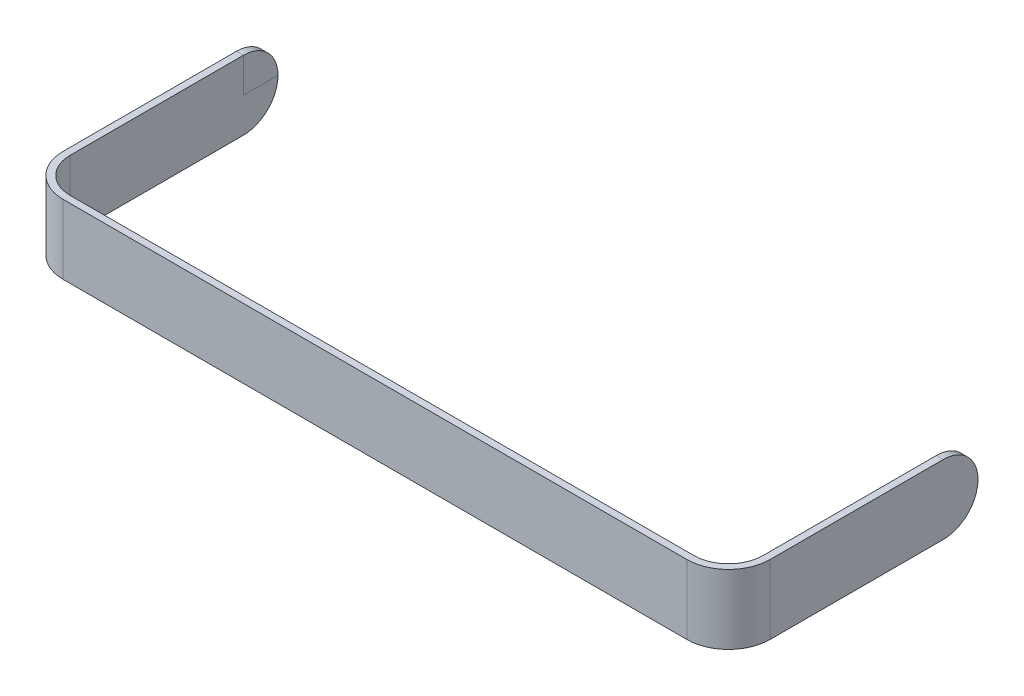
SolidWorks part; units mm, degrees
ref_plane "Front Plane" through (0, 0, 0) normal (0, 0, 1) x (1, 0, 0)
ref_plane "Top Plane" through (0, 0, 0) normal (0, 1, 0) x (1, 0, 0)
ref_plane "Right Plane" through (0, 0, 0) normal (1, 0, 0) x (0, 0, -1)
sketch "Sketch6" plane through (0, 0, 0) normal (0, 1, 0) x (1, 0, 0)
  line L0 (-450, 0) -> (450, 0)
  line L1 (500, 50) -> (500, 300)
  line L2 (-500, 50) -> (-500, 300)
  line L3 (-510, 50) -> (-510, 300)
  line L4 (-450, -10) -> (450, -10)
  line L5 (510, 50) -> (510, 300)
  line L6 (-510, 300) -> (-500, 300)
  line L7 (500, 300) -> (510, 300)
  arc A0 (-450, 0) -> (-500, 50) centre (-450, 50) cw
  arc A1 (500, 50) -> (450, 0) centre (450, 50) cw
  arc A2 (-450, -10) -> (-510, 50) centre (-450, 50) cw
  arc A3 (510, 50) -> (450, -10) centre (450, 50) cw
  point P7 (-500, 0)
  point P11 (500, 0)
  dimension "D4" = 50
  dimension "D5" = 50
  dimension "D1" = 1000
  dimension "D2" = 500
  dimension "D3" = 300
  dimension "D6" = 10
extrude "Extrude1" add sketch "Sketch6" along normal mid plane 100
sketch "Sketch9" plane through (-500, 0, 0) normal (1, 0, 0) x (0, 0, -1)
  line L0 (300, 50) -> (300, -50) construction
  line L1 (300, 50) -> (300, -50)
  arc A0 (300, -50) -> (300, 50) centre (300, 0) ccw
extrude "Extrude2" add sketch "Sketch9" against normal up to surface (1010 mm away)
sketch "Sketch10" plane through (500, 0, 0) normal (-1, 0, 0) x (0, 0, 1)
  line L0 (-300, 50) -> (-300, -50) construction
  line L1 (-300, 50) -> (-300, -50)
  arc A0 (-300, 50) -> (-300, -50) centre (-300, 0) ccw
extrude "Extrude3" add sketch "Sketch10" against normal up to surface (10 mm away)
sketch "Sketch11" plane through (0, 0, 0) normal (1, 0, 0) x (0, 0, -1)
  line L0 (300, 50) -> (300, 0)
  line L1 (300, 0) -> (350, 0)
  arc A0 (300, -50) -> (300, 50) centre (300, 0) ccw construction
  arc A1 (350, 0) -> (300, 50) centre (300, 0) ccw
